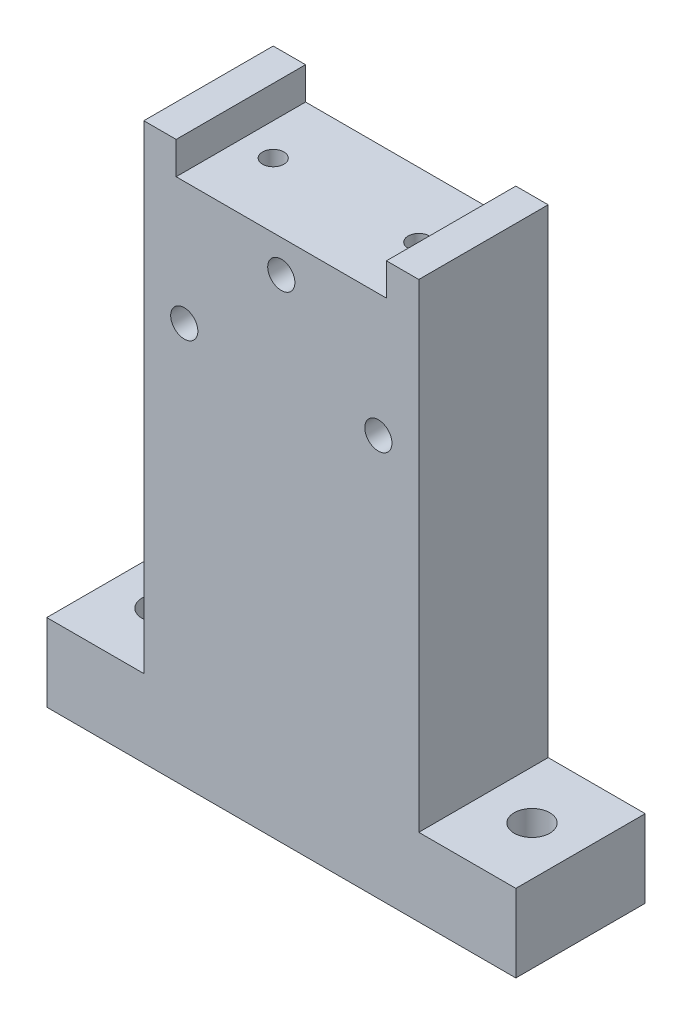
SolidWorks part; units mm, degrees
ref_plane "前视基准面" through (0, 0, 0) normal (0, 0, 1) x (1, 0, 0)
ref_plane "上视基准面" through (0, 0, 0) normal (0, 1, 0) x (1, 0, 0)
ref_plane "右视基准面" through (0, 0, 0) normal (1, 0, 0) x (0, 0, -1)
sketch "草图1" plane through (0, 0, 0) normal (0, 0, 1) x (1, 0, 0)
  line L0 (20, 81) -> (20, 86)
  line L1 (52.5, 81) -> (52.5, 86)
  line L2 (57.5, 12) -> (57.5, 86)
  line L3 (15, 12) -> (15, 86)
  line L4 (0, 0) -> (0, 12)
  line L5 (72.5, 0) -> (72.5, 12)
  line L6 (0, 0) -> (72.5, 0)
  line L7 (20, 81) -> (52.5, 81)
  line L8 (15, 86) -> (20, 86)
  line L9 (0, 12) -> (15, 12)
  line L10 (52.5, 86) -> (57.5, 86)
  line L11 (57.5, 12) -> (72.5, 12)
extrude "凸台-拉伸1" add sketch "草图1" along normal blind 20
sketch "草图2" plane through (0, 0, 20) normal (0, 0, 1) x (1, 0, 0)
  circle A0 centre (21.25, 62) radius 2.1
  circle A1 centre (51.25, 62) radius 2.1
  circle A2 centre (36.25, 76) radius 2.1
extrude "切除-拉伸1" cut sketch "草图2" against normal blind 20
sketch "草图3" plane through (0, 12, 0) normal (0, 1, 0) x (1, 0, 0)
  circle A0 centre (7.5, -10) radius 2.75
  circle A1 centre (65, -10) radius 2.75
extrude "切除-拉伸2" cut sketch "草图3" against normal blind 20
sketch "草图4" plane through (0, 81, 0) normal (0, 1, 0) x (1, 0, 0)
  circle A0 centre (25, -10) radius 1.65
  circle A1 centre (47.5, -10) radius 1.65
extrude "切除-拉伸3" cut sketch "草图4" against normal blind 12
